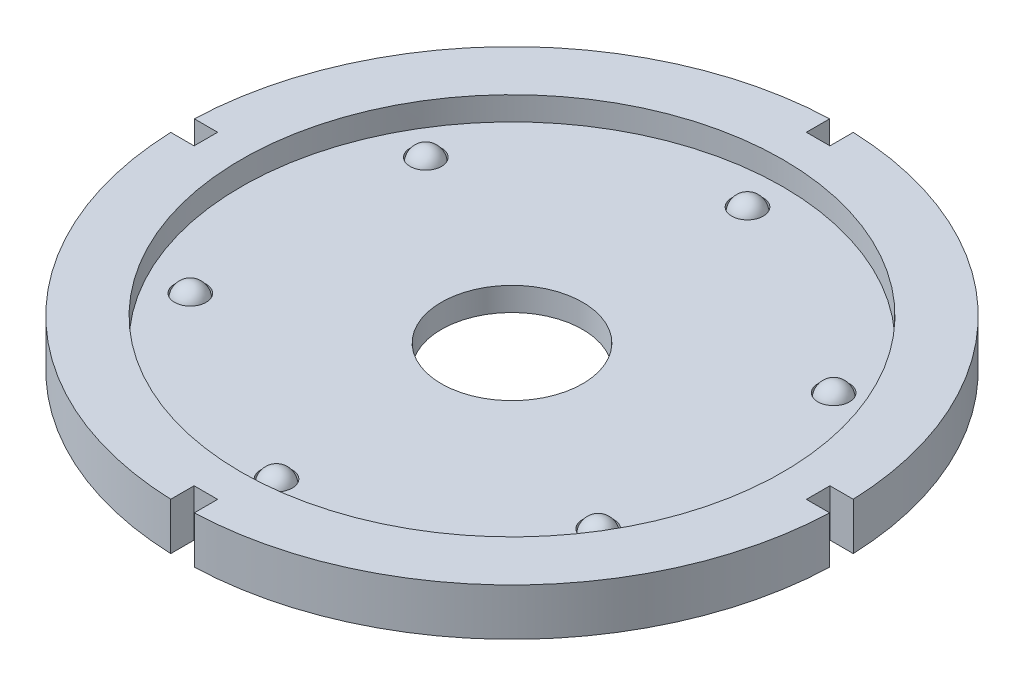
SolidWorks part; units mm, degrees
ref_plane "Alzado" through (0, 0, 0) normal (0, 0, 1) x (1, 0, 0)
ref_plane "Planta" through (0, 0, 0) normal (0, 1, 0) x (1, 0, 0)
ref_plane "Vista lateral" through (0, 0, 0) normal (1, 0, 0) x (0, 0, -1)
sketch "Croquis2" plane through (0, 0, 0) normal (0, 1, 0) x (1, 0, 0)
  circle A0 centre (0, 0) radius 57.5
  circle A1 centre (0, 0) radius 70
  dimension "D1" = 115
  dimension "D2" = 140
extrude "Saliente-Extruir1" add sketch "Croquis2" along normal blind 10
sketch "Croquis3" plane through (0, 0, 0) normal (0, -1, 0) x (-1, 0, 0)
  circle A1 centre (0, 0) radius 57.5 construction
  circle A2 centre (0, 0) radius 57.5
extrude "Saliente-Extruir2" add sketch "Croquis3" against normal blind 5
sketch "Croquis6" plane through (0, 10, 0) normal (0, 1, 0) x (1, 0, 0)
  line L0 (0, 0) -> (35355.3391, -35355.3391) construction
  line L1 (0, 0) -> (35355.3391, 35355.3391) construction
  line L2 (0, 0) -> (0, 50000) construction
  line L3 (0, 0) -> (50000, 0) construction
  circle A3 centre (38.3796, -38.3796) radius 2.5
  dimension "D2" = 5
  dimension "D1" = 45
sketch "Croquis7" plane through (0, 5, 0) normal (0, 1, 0) x (1, 0, 0)
  circle A0 centre (0, 0) radius 15
  dimension "D1" = 30
extrude "Cortar-Extruir1" cut sketch "Croquis7" against normal up to next
sketch "Croquis8" plane through (0, 146.9375, 12.3215) normal (1, 0, 0) x (0, 0, -1)
  line L2 (12.3215, -143.2616) -> (12.3215, -50143.2616) construction
  line L3 (-37.6785, -139.4375) -> (-37.6785, -146.4375)
  circle A0 centre (-37.6785, -142.9375) radius 3.5 construction
  arc A1 (-37.6785, -139.4375) -> (-37.6785, -146.4375) centre (-37.6785, -142.9375) ccw
  dimension "D1" = 7
  dimension "D2" = 50
revolve "Cortar-Revolución2" cut sketch "Croquis8" angle 360 about L3
pattern_circular "MatrizC2" count 6 over 360 about axis through (0, 0, 0) along (0, 1, 0) of "Cortar-Revolución2"
sketch "Croquis10" plane through (0, 0, 0) normal (1, 0, 0) x (0, 0, -1)
  line L0 (-50.0079, 4.8642) -> (-50.0079, 3.8642) construction
  line L3 (-50.0079, 7.1142) -> (-50.0079, 0.6142)
  circle A0 centre (-50.0079, 3.8642) radius 3.25 construction
  arc A1 (-50.0079, 7.1142) -> (-50.0079, 0.6142) centre (-50.0079, 3.8642) ccw
  dimension "D2" = 6.5
  dimension "D3" = 1
revolve "Revolución1" add sketch "Croquis10" angle 360 about L3
pattern_circular "MatrizC5" count 6 over 360 about axis through (0, 0, 0) along (0, 1, 0)
sketch "Croquis12" plane through (0, 10, 0) normal (0, 1, 0) x (1, 0, 0)
  line L0 (0, 65) -> (0, 0) construction
  line L1 (-2.5, 65) -> (2.5, 65)
  line L2 (-2.5, 65) -> (-2.5, 75)
  line L3 (-2.5, 75) -> (2.5, 75)
  line L4 (2.5, 65) -> (2.5, 75)
  line L5 (0, 0) -> (65, 0) construction
  line L6 (65, 2.5) -> (75, 2.5)
  line L7 (65, 2.5) -> (65, -2.5)
  line L8 (65, -2.5) -> (75, -2.5)
  line L9 (75, 2.5) -> (75, -2.5)
  line L10 (2.5, -65) -> (2.5, -75)
  line L11 (-2.5, -75) -> (2.5, -75)
  line L12 (-2.5, -65) -> (-2.5, -75)
  line L13 (-2.5, -65) -> (2.5, -65)
  line L14 (65, 2.5) -> (75, 2.5)
  line L15 (65, -2.5) -> (75, -2.5)
  line L16 (-65, -2.5) -> (-75, -2.5)
  line L17 (-75, 2.5) -> (-75, -2.5)
  line L18 (-65, 2.5) -> (-75, 2.5)
  line L19 (-65, 2.5) -> (-65, -2.5)
  dimension "D1" = 5
  dimension "D2" = 65
  dimension "D3" = 75
  dimension "D4" = 75
extrude "Cortar-Extruir2" cut sketch "Croquis12" against normal through all and the other way through all contours L9 L6 L8 M9 | L7 L8 L6 M9 | L13 L12 L10 M9 | L12 L11 L10 M9 | L18 L17 L16 M9 | L19 L18 L16 M9 | L4 L3 L2 M9 | L1 L4 L2 M9
